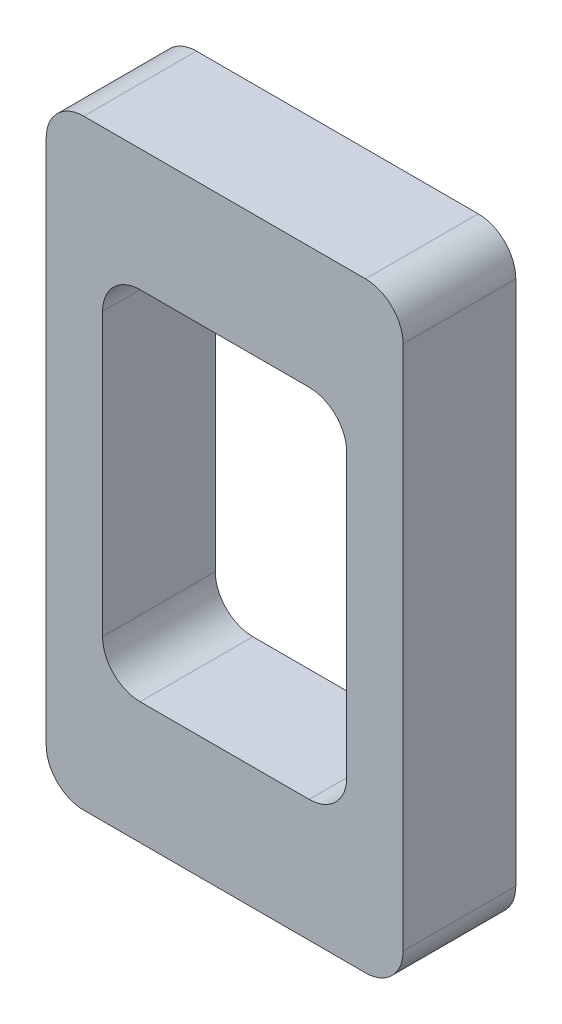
SolidWorks part; units mm, degrees
ref_plane "Plan de face" through (0, 0, 0) normal (0, 0, 1) x (1, 0, 0)
ref_plane "Plan de dessus" through (0, 0, 0) normal (0, 1, 0) x (1, 0, 0)
ref_plane "Plan de droite" through (0, 0, 0) normal (1, 0, 0) x (0, 0, -1)
sketch "Esquisse1" plane through (0, 0, 0) normal (0, 0, 1) x (1, 0, 0)
  line L0 (-59.05, 42.3398) -> (-59.05, 32.8398)
  line L1 (-59.05, 42.3398) -> (-52.55, 42.3398)
  line L2 (-59.05, 32.8398) -> (-52.55, 32.8398)
  line L3 (-52.55, 42.3398) -> (-52.55, 32.8398)
  line L4 (-58.8, 45.5898) -> (-52.8, 45.5898) construction
  line L5 (-60.55, 45.5898) -> (-60.55, 29.5898)
  line L7 (-60.55, 45.5898) -> (-51.05, 45.5898)
  line L8 (-51.05, 45.5898) -> (-51.05, 29.5898)
  line L9 (-55.8, 42.8085) -> (-55.8, 34.5241) construction
  line L10 (-55.8, 29.5898) -> (-58.8, 29.5898) construction
  line L11 (-51.05, 29.5898) -> (-60.55, 29.5898)
  line L12 (-52.8, 44.5898) -> (-52.8, 40.5898) construction
  line L13 (-58.8, 30.5898) -> (-58.8, 44.5898) construction
  line L14 (-59.6005, 37.5898) -> (-50.0757, 37.5898) construction
  dimension "D2" = 9.5
  dimension "D1" = 6.5
  dimension "D3" = 9.5
extrude "Extrusion1" add sketch "Esquisse1" along normal blind 3
fillet "Congé1" radius 1 8 edges at (-60.55, 29.5898, 1.5) (-60.55, 45.5898, 1.5) (-51.05, 29.5898, 1.5) (-51.05, 45.5898, 1.5) (-52.55, 32.8398, 1.5) (-59.05, 32.8398, 1.5) (-59.05, 42.3398, 1.5) (-52.55, 42.3398, 1.5)
